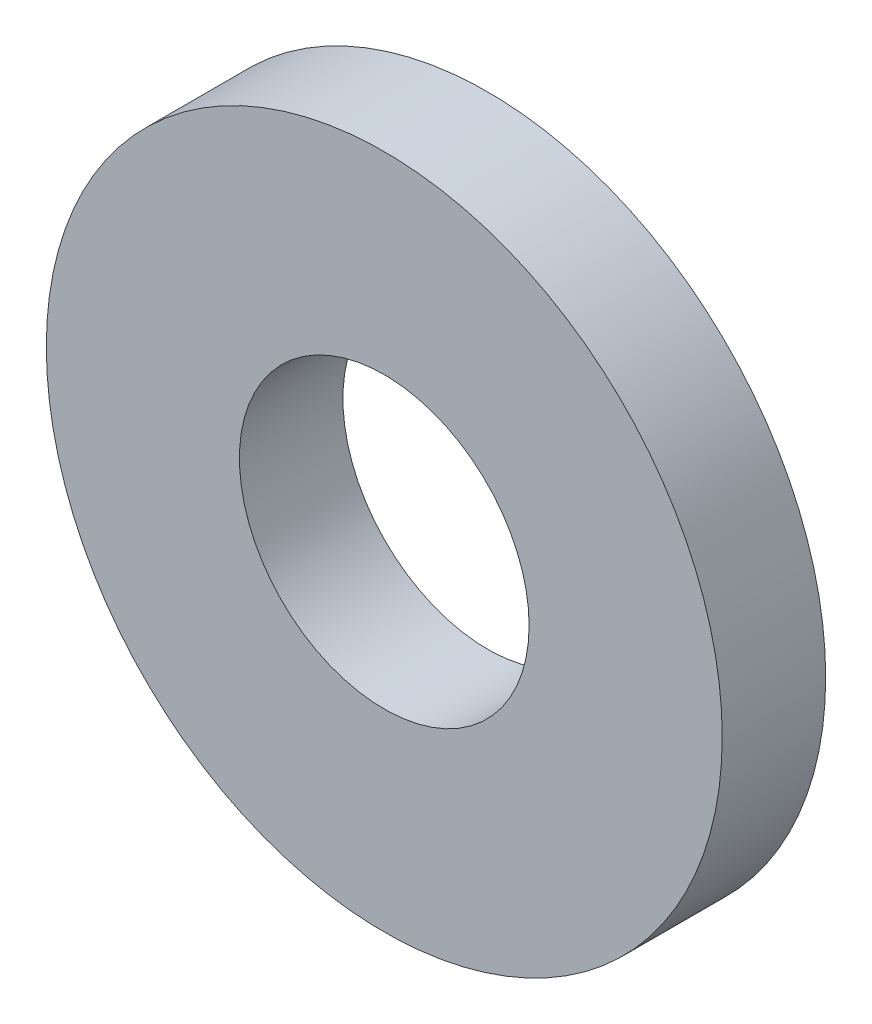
SolidWorks part; units mm, degrees
ref_plane "Front Plane" through (0, 0, 0) normal (0, 0, 1) x (1, 0, 0)
ref_plane "Top Plane" through (0, 0, 0) normal (0, 1, 0) x (1, 0, 0)
ref_plane "Right Plane" through (0, 0, 0) normal (1, 0, 0) x (0, 0, -1)
ref_plane "Plane1"
sketch "Sketch1" plane through (0, 0, 0) normal (0, 0, 1) x (1, 0, 0)
  circle A0 centre (0, 0) radius 12.25
  circle A1 centre (0, 0) radius 5.25
  dimension "D1" = 10.5
  dimension "D2" = 24.5
extrude "Extrusion1" add sketch "Sketch1" along normal blind 3.75 contours A0 A1
